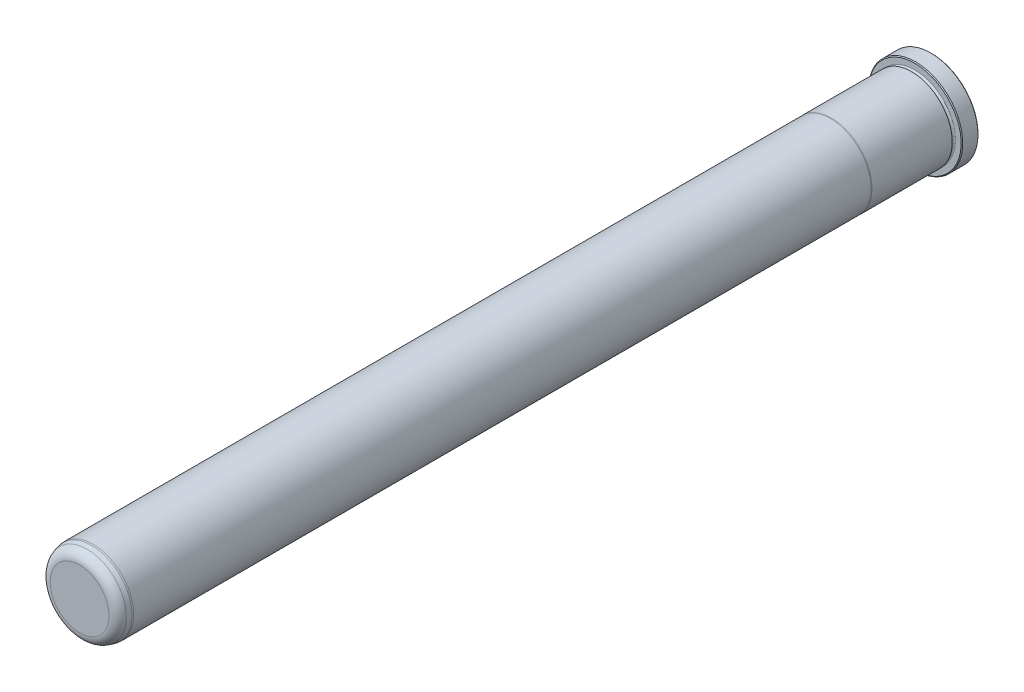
SolidWorks part; units mm, degrees
ref_plane "Front Plane" through (0, 0, 0) normal (0, 0, 1) x (1, 0, 0)
ref_plane "Top Plane" through (0, 0, 0) normal (0, 1, 0) x (1, 0, 0)
ref_plane "Right Plane" through (0, 0, 0) normal (1, 0, 0) x (0, 0, -1)
sketch "Sketch1" plane through (0, 0, 0) normal (1, 0, 0) x (0, 0, -1)
  line L0 (0, 0) -> (0, 22.098)
  line L1 (0, 22.098) -> (-7.9248, 22.098)
  line L2 (-7.9248, 22.098) -> (-7.9248, 19.0373)
  line L3 (-7.9248, 18.2753) -> (-9.4488, 18.2753) construction
  line L4 (-9.4488, 19.0373) -> (-9.4488, 19.0627)
  line L5 (-9.4488, 19.0627) -> (-47.1348, 19.0627)
  line L6 (-47.1348, 19.0627) -> (-47.498, 19.0373)
  line L7 (-47.498, 19.0373) -> (-393.7, 19.0373)
  line L9 (-400.05, 17.4733) -> (-400.05, 0)
  line L10 (-400.05, 0) -> (0, 0)
  line L11 (0, 0) -> (13.6287, 0) construction
  line L12 (-393.7, 19.0373) -> (-394.462, 18.9706)
  line L13 (-394.462, 18.9706) -> (-400.05, 17.4733)
  arc A0 (-9.4488, 19.0373) -> (-7.9248, 19.0373) centre (-8.6868, 19.0373) ccw
  dimension "D14" = 1.524
  dimension "D1" = 7.9248
  dimension "D2" = 1.524
  dimension "D3" = 44.196
  dimension "D4" = 38.1254
  dimension "D5" = 47.498
  dimension "D6" = 400.05
  dimension "D7" = 0.7874
  dimension "D8" = 4
  dimension "D9" = 38.0746
  dimension "D10" = 5
  dimension "D11" = 15
  dimension "D12" = 0.762
  dimension "D13" = 6.35
revolve "Revolve1" add sketch "Sketch1" angle 360 about L11
fillet "Fillet6" radius 4.7625 1 edges at (17.4733, 0, 400.05)
chamfer "Chamfer1" distance 0.381 angle 45 2 edges at (22.098, 0, 0) (22.098, 0, 7.9248)
